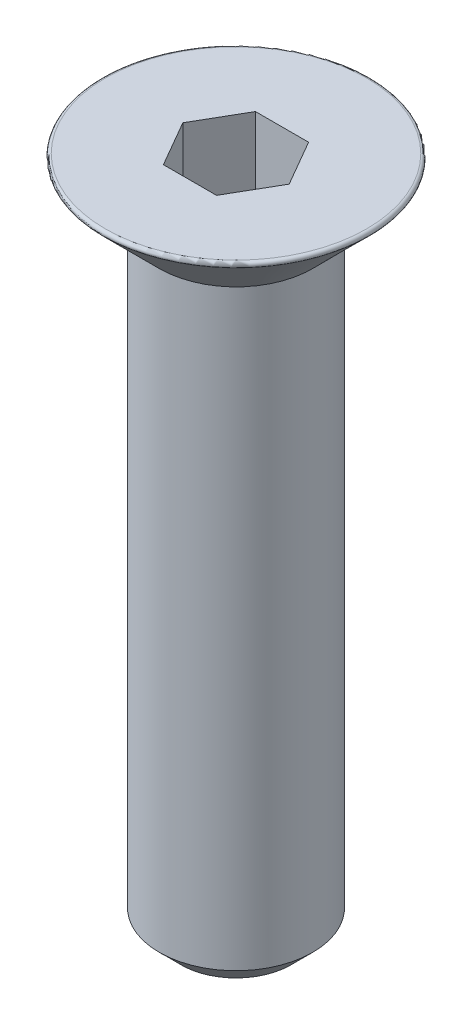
SolidWorks part; units mm, degrees
ref_plane "Plan de face" through (0, 0, 0) normal (0, 0, 1) x (1, 0, 0)
ref_plane "Plan de dessus" through (0, 0, 0) normal (0, 1, 0) x (1, 0, 0)
ref_plane "Plan de droite" through (0, 0, 0) normal (1, 0, 0) x (0, 0, -1)
sketch "Esquisse1" plane through (0, 0, 0) normal (0, 0, 1) x (1, 0, 0)
  line L0 (0, 15.488) -> (0, -29.9279) construction
  line L1 (0, 0) -> (-4.5, 0)
  line L2 (-4.5, 0) -> (-2.5, -2)
  line L3 (-2.5, -2) -> (-2.5, -22)
  line L4 (-2.5, -22) -> (0, -22)
  line L5 (0, 0) -> (0, -22)
  dimension "D1" = 4.5
  dimension "D2" = 2.5
  dimension "D3" = 45
  dimension "D4" = 20
revolve "Révolution1" add sketch "Esquisse1" angle 360 about L0
fillet "Congé1" radius 0.1 1 edges at (0, 0, 4.5)
chamfer "Chanfrein1" distance 0.7 angle 45 1 edges at (0, -22, 2.5)
sketch "Esquisse2" plane through (0, 0, 0) normal (0, 1, 0) x (1, 0, 0)
  line L1 (1.7321, 0) -> (0.866, 1.5)
  line L2 (0.866, 1.5) -> (-0.866, 1.5)
  line L3 (-0.866, 1.5) -> (-1.7321, 0)
  line L4 (-1.7321, 0) -> (-0.866, -1.5)
  line L5 (-0.866, -1.5) -> (0.866, -1.5)
  line L6 (0.866, -1.5) -> (1.7321, 0)
  circle A0 centre (0, 0) radius 1.5 construction
  dimension "D1" = 3
extrude "Enlèv. mat.-Extru.1" cut sketch "Esquisse2" against normal blind 3
